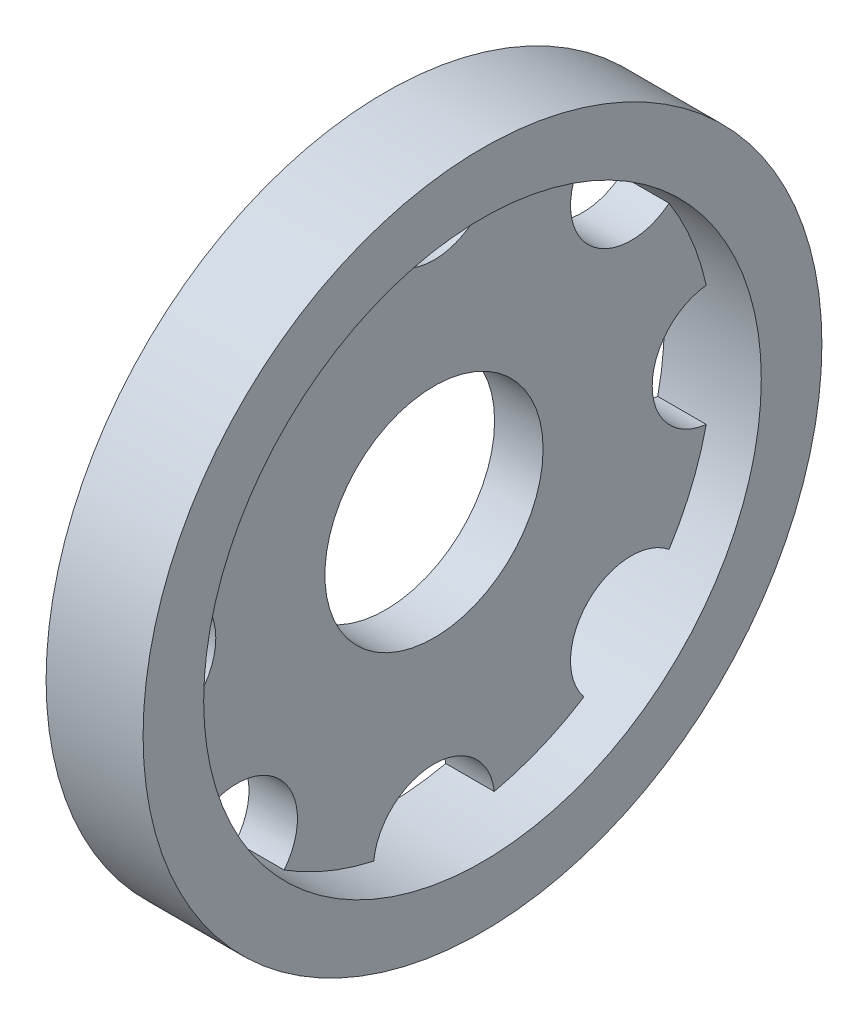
SolidWorks part; units mm, degrees
ref_plane "Plano frontal" through (0, 0, 0) normal (0, 0, 1) x (1, 0, 0)
ref_plane "Plano superior" through (0, 0, 0) normal (0, 1, 0) x (1, 0, 0)
ref_plane "Plano direito" through (0, 0, 0) normal (1, 0, 0) x (0, 0, -1)
sketch "Esboço1" plane through (0, 0, 0) normal (1, 0, 0) x (0, 0, -1)
  circle A0 centre (0, 0) radius 4.5
  circle A1 centre (0, 0) radius 11.5
  circle A2 centre (0, 11.5) radius 2.5
  circle A3 centre (0, 0) radius 4.5
  circle A4 centre (8.1317, 8.1317) radius 2.5
  circle A5 centre (0, 0) radius 4.5
  circle A6 centre (11.5, 0) radius 2.5
  circle A7 centre (0, 0) radius 4.5
  circle A8 centre (8.1317, -8.1317) radius 2.5
  circle A9 centre (0, 0) radius 4.5
  circle A10 centre (0, -11.5) radius 2.5
  circle A11 centre (0, 0) radius 4.5
  circle A12 centre (-8.1317, -8.1317) radius 2.5
  circle A13 centre (0, 0) radius 4.5
  circle A14 centre (-11.5, 0) radius 2.5
  circle A15 centre (0, 0) radius 4.5
  circle A16 centre (-8.1317, 8.1317) radius 2.5
  point P29 (0, 0)
  dimension "D1" = 9
  dimension "D2" = 23
  dimension "D3" = 5
  dimension "D4" = 8
extrude "Ressalto-extrusão1" add sketch "Esboço1" along normal blind 2 contours A16 A1 A14 A12 A10 A8 A6 A4 A2 A0
sketch "Esboço2" plane through (2, 0, 0) normal (1, 0, 0) x (0, 0, -1)
  circle A0 centre (0, 0) radius 11.5
  circle A1 centre (0, 0) radius 14
  dimension "D1" = 28
  dimension "D2" = 23
extrude "Ressalto-extrusão2" add sketch "Esboço2" along normal mid plane 4
